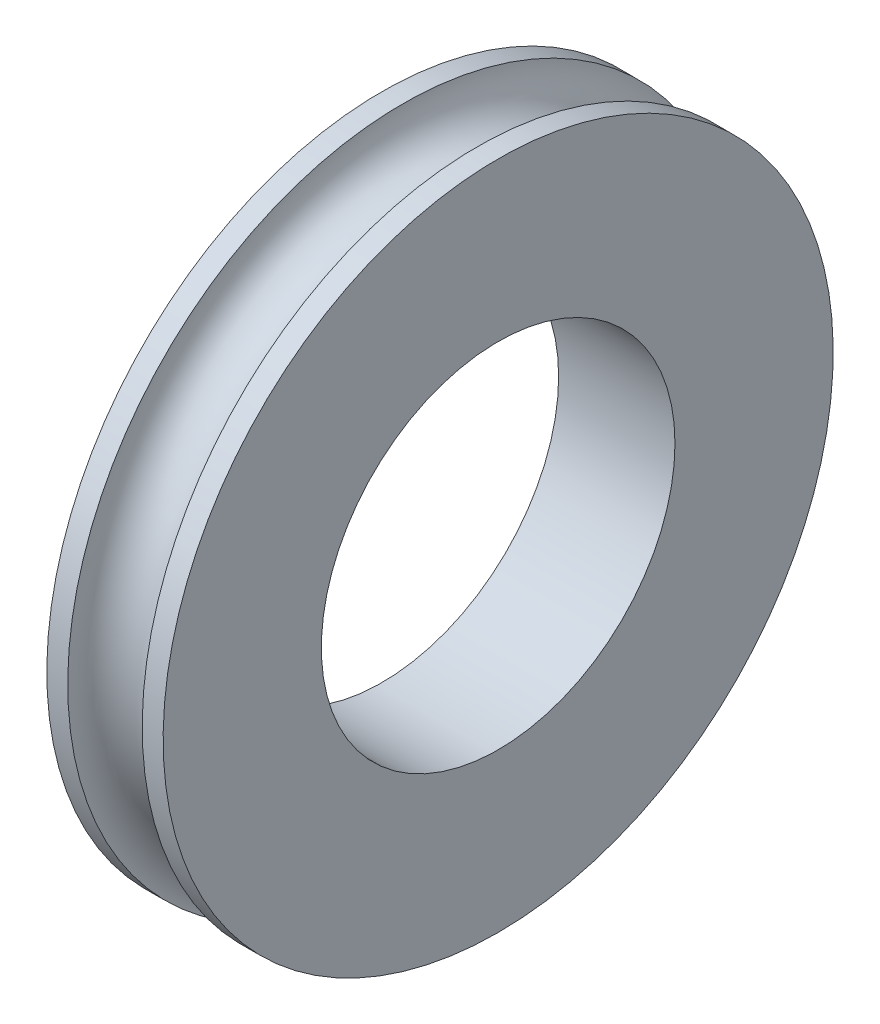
SolidWorks part; units mm, degrees
ref_plane "Front Plane" through (0, 0, 0) normal (0, 0, 1) x (1, 0, 0)
ref_plane "Top Plane" through (0, 0, 0) normal (0, 1, 0) x (1, 0, 0)
ref_plane "Right Plane" through (0, 0, 0) normal (1, 0, 0) x (0, 0, -1)
sketch "Sketch1" plane through (0, 0, 0) normal (0, 0, 1) x (1, 0, 0)
  line L0 (-3.125, 0) -> (3.125, 0)
  line L1 (-3.125, 0) -> (-3.125, 18)
  line L2 (3.125, 0) -> (3.125, 18)
  line L3 (-3.125, 18) -> (-2, 18)
  line L4 (3.125, 18) -> (2, 18)
  line L5 (-22.9962, 0) -> (22.9962, 0) construction
  arc A0 (-2, 18) -> (2, 18) centre (0, 18) ccw
  point P3 (0, 0)
  point P11 (0, 0)
  dimension "D6" = 2
  dimension "D1" = 6.25
  dimension "D2" = 18
  dimension "D3" = 18
  dimension "D4" = 1.125
  dimension "D5" = 1.125
revolve "Revolve1" add sketch "Sketch1" angle 360 about L5
hole_wizard "Ø19.0 (19) Diameter Hole1" positions "Sketch3" profile "Sketch2" hole size "Ø19.0" standard "Ansi Metric"
sketch "Sketch3" plane through (3.125, 0, 0) normal (1, 0, 0) x (0, 0, -1)
  point P0 (0, 0)
sketch "Sketch2" plane through (3.125, 0, 0) normal (0, 1, 0) x (0, 0, -1)
  line L0 (0, 0) -> (0, 6.25)
  line L1 (0, 6.25) -> (9.5, 6.25)
  line L2 (9.5, 6.25) -> (9.5, 0)
  line L5 (9.5, 0) -> (0, 0)
  line L11 (0, -6.35) -> (0, 107.95) construction
  dimension "Thru Hole Dia." = 19
  dimension "Thru Hole Depth" = 6.25
